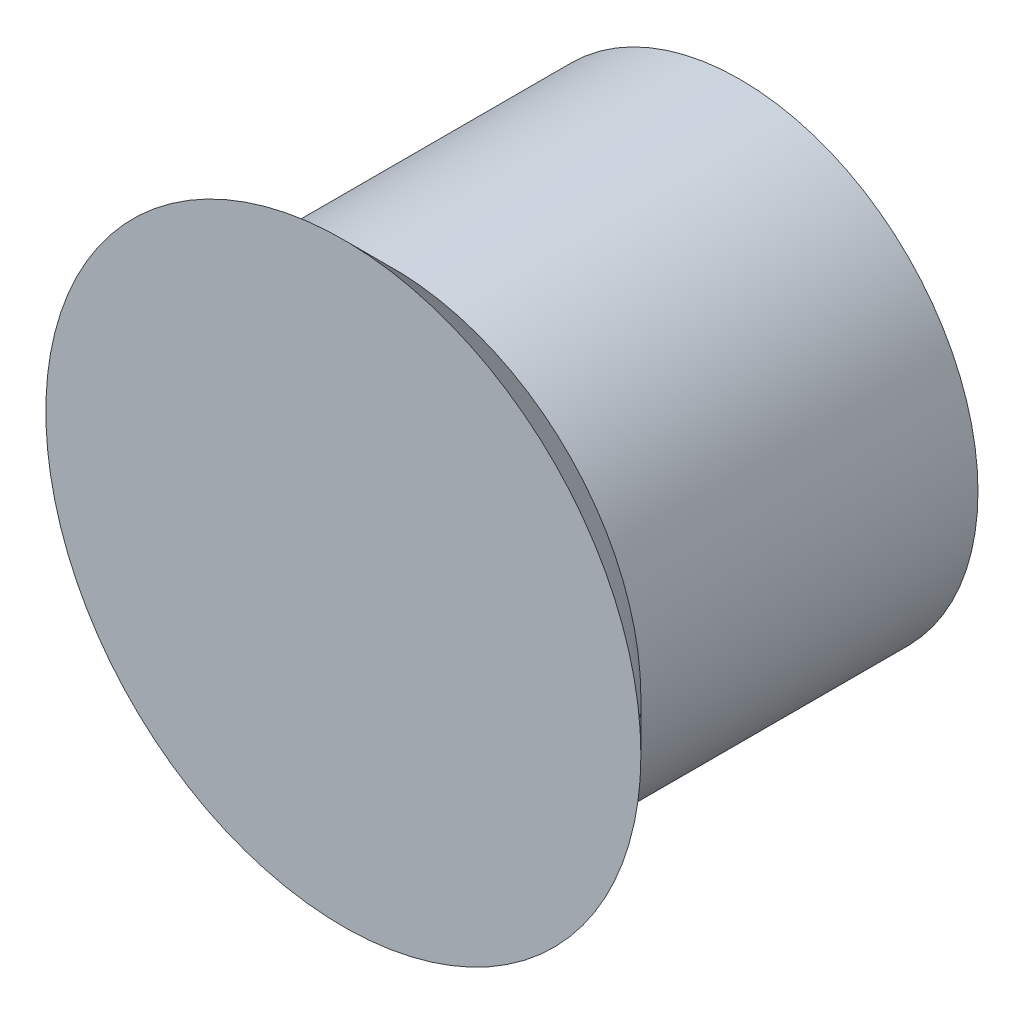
SolidWorks part; units mm, degrees
ref_plane "Ön Düzlem" through (0, 0, 0) normal (0, 0, 1) x (1, 0, 0)
ref_plane "Üst Düzlem" through (0, 0, 0) normal (0, 1, 0) x (1, 0, 0)
ref_plane "Sağ Düzlem" through (0, 0, 0) normal (1, 0, 0) x (0, 0, -1)
sketch "Çizim1" plane through (0, 0, 0) normal (0, 0, 1) x (1, 0, 0)
  circle A0 centre (0, 0) radius 2.4
  dimension "D1" = 4.8
extrude "Yükseklik-Ekstrüzyon1" add sketch "Çizim1" along normal blind 3.5
sketch "Çizim2" plane through (0, 0, 3.5) normal (0, 0, 1) x (1, 0, 0)
  circle A0 centre (0, 0) radius 2.5005
extrude "Yükseklik-Ekstrüzyon2" add sketch "Çizim2" along normal blind 0.5 draft 45
